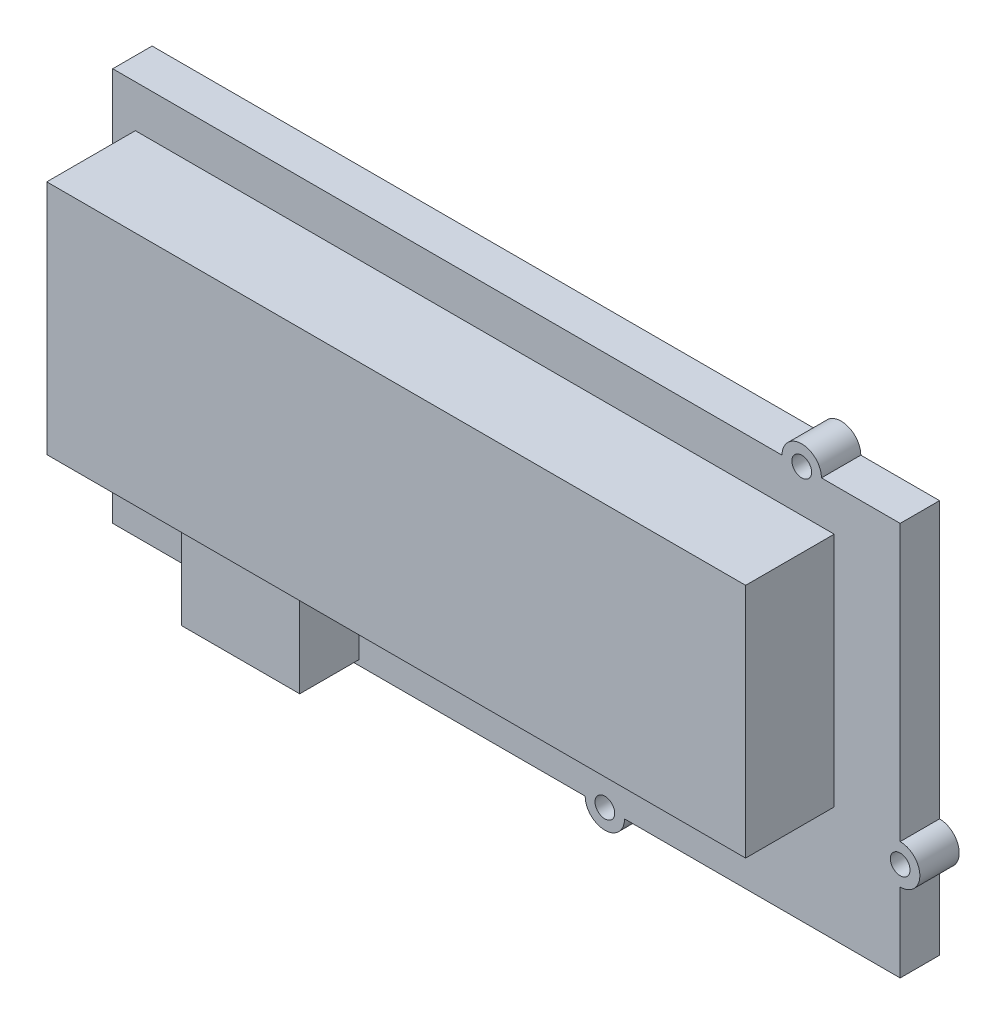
SolidWorks part; units mm, degrees
ref_plane "Plan de face" through (0, 0, 0) normal (0, 0, 1) x (1, 0, 0)
ref_plane "Plan de dessus" through (0, 0, 0) normal (0, 1, 0) x (1, 0, 0)
ref_plane "Plan de droite" through (0, 0, 0) normal (1, 0, 0) x (0, 0, -1)
sketch "Esquisse2" plane through (0, 0, 0) normal (0, 0, 1) x (1, 0, 0)
  line L1 (0, 0) -> (80, 0)
  line L2 (0, 0) -> (0, 40)
  line L3 (0, 40) -> (80, 40)
  line L4 (80, 0) -> (80, 40)
  dimension "D1" = 80
  dimension "D2" = 40
extrude "Boss.-Extru.1" add sketch "Esquisse2" along normal blind 4
sketch "Esquisse3" plane through (0, 0, 4) normal (0, 0, 1) x (1, 0, 0)
  line L0 (0, 40) -> (0, 0) construction
  line L1 (80, 40) -> (0, 40) construction
  line L2 (80, 0) -> (80, 40) construction
  line L3 (0, 0) -> (80, 0) construction
  circle A0 centre (0, 30) radius 2
  circle A2 centre (70, 40) radius 2
  circle A3 centre (80, 10) radius 2
  circle A4 centre (50, 0) radius 2
  circle A5 centre (10, 0) radius 2
  dimension "D1" = 4
  dimension "D3" = 4
  dimension "D4" = 4
  dimension "D5" = 4
  dimension "D6" = 4
  dimension "D7" = 10
  dimension "D8" = 10
  dimension "D9" = 10
  dimension "D10" = 10
  dimension "D12" = 30
extrude "Boss.-Extru.2" add sketch "Esquisse3" against normal blind 4
sketch "Esquisse4" plane through (0, 0, 4) normal (0, 0, 1) x (1, 0, 0)
  circle A0 centre (0, 30) radius 1
  circle A2 centre (70, 40) radius 1
  circle A3 centre (80, 10) radius 1
  circle A4 centre (10, 0) radius 1.3768
  circle A5 centre (50, 0) radius 1
  dimension "D1" = 2
  dimension "D3" = 2
  dimension "D4" = 2
  dimension "D5" = 2
  dimension "D6" = 2.7535
extrude "Enlèv. mat.-Extru.1" cut sketch "Esquisse4" against normal through all
sketch "Esquisse5" plane through (0, 0, 4) normal (0, 0, 1) x (1, 0, 0)
  line L0 (0, 28) -> (0, 0) construction
  line L1 (2.3, 35.7) -> (73.3, 35.7)
  line L2 (2.3, 35.7) -> (2.3, 11.7)
  line L3 (2.3, 11.7) -> (73.3, 11.7)
  line L4 (73.3, 35.7) -> (73.3, 11.7)
  line L6 (68, 40) -> (0, 40) construction
  dimension "D1" = 24
  dimension "D2" = 71
  dimension "D3" = 2.3
  dimension "D4" = 4.3
extrude "Boss.-Extru.3" add sketch "Esquisse5" along normal blind 9
sketch "Esquisse6" plane through (0, 0, 4) normal (0, 0, 1) x (1, 0, 0)
  line L0 (12, 0) -> (48, 0) construction
  line L1 (13, 10.5) -> (25, 10.5)
  line L2 (13, 10.5) -> (13, 0.5)
  line L3 (13, 0.5) -> (25, 0.5)
  line L4 (25, 10.5) -> (25, 0.5)
  line L5 (0, 28) -> (0, 0) construction
  dimension "D1" = 12
  dimension "D2" = 10
  dimension "D3" = 0.5
  dimension "D4" = 13
extrude "Boss.-Extru.4" add sketch "Esquisse6" along normal blind 6
